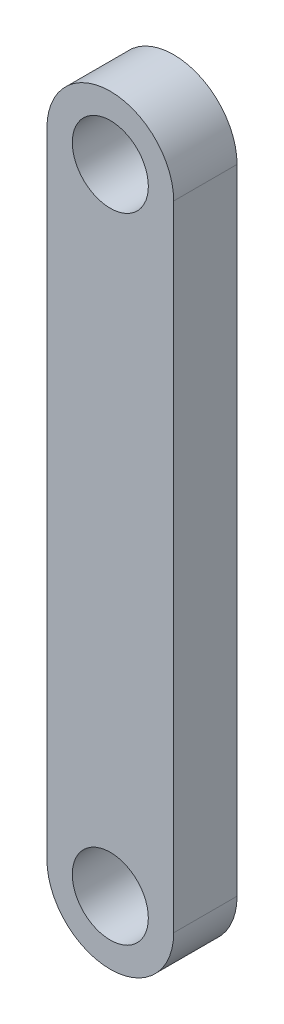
SolidWorks part; units mm, degrees
ref_plane "Front Plane" through (0, 0, 0) normal (0, 0, 1) x (1, 0, 0)
ref_plane "Top Plane" through (0, 0, 0) normal (0, 1, 0) x (1, 0, 0)
ref_plane "Right Plane" through (0, 0, 0) normal (1, 0, 0) x (0, 0, -1)
sketch "Sketch1" plane through (0, 0, 0) normal (0, 0, 1) x (1, 0, 0)
  line L0 (0, 0) -> (0, 50) construction
  line L1 (5, 0) -> (5, 50)
  line L2 (-5, 0) -> (-5, 50)
  arc A0 (5, 0) -> (-5, 0) centre (0, 0) cw
  arc A1 (5, 50) -> (-5, 50) centre (0, 50) ccw
  circle A2 centre (0, 50) radius 3
  circle A3 centre (0, 0) radius 3
  dimension "D4" = 6
  dimension "D1" = 50
  dimension "D2" = 5
  dimension "D3" = 5
extrude "Extrude1" add sketch "Sketch1" along normal mid plane 5
